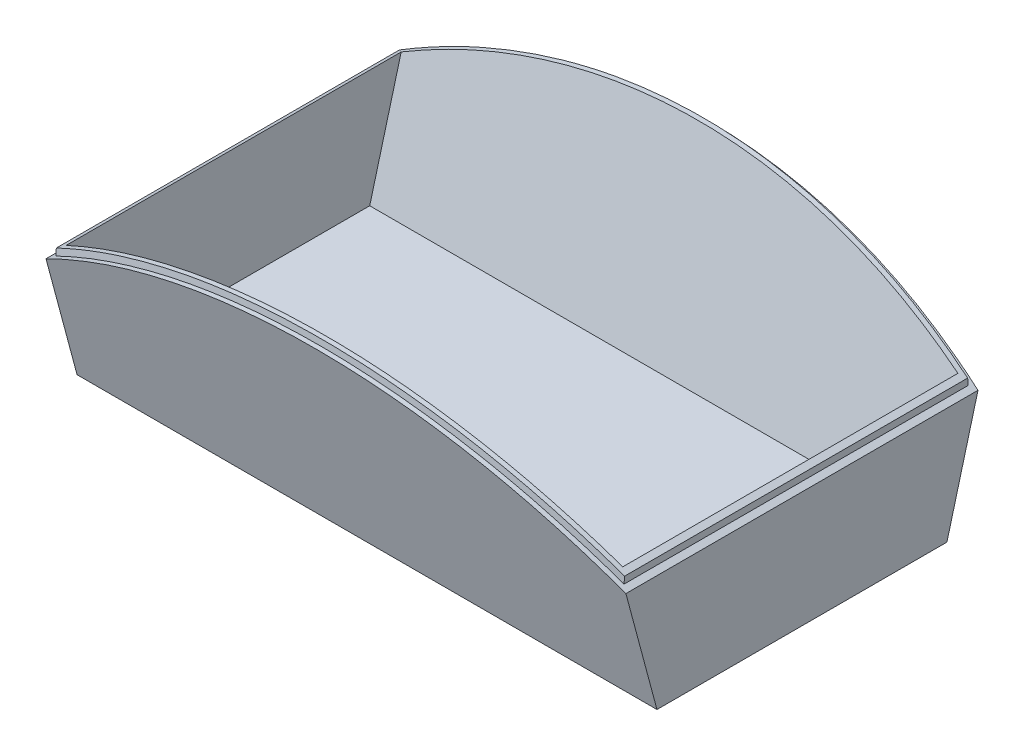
SolidWorks part; units mm, degrees
ref_plane "Płaszczyzna przednia" through (0, 0, 0) normal (0, 0, 1) x (1, 0, 0)
ref_plane "Płaszczyzna górna" through (0, 0, 0) normal (0, 1, 0) x (1, 0, 0)
ref_plane "Płaszczyzna prawa" through (0, 0, 0) normal (1, 0, 0) x (0, 0, -1)
body saved out of another part "Zapas-Przykład-1"
sketch3d "Szkic 3D4"
  spline S0 degree 3 poles (-174.8395, -1884.9923, -480.6472) (109.277, -830.1738, -198.7777) (249.2734, -57.4636, 8.3553) (36.4942, 27.5798, 31.1538) (35.4962, 27.9605, 31.2558) (33.4846, 28.6913, 31.4518) (32.4697, 29.0419, 31.5457) (29.4186, 30.0418, 31.8138) (27.3725, 30.6408, 31.9744) (21.1984, 32.2393, 32.4029) (17.035, 33.041, 32.6178) (8.6141, 34.1189, 32.9068) (4.3566, 34.3953, 32.9809) (-2.1034, 34.3985, 32.9818) (-4.2563, 34.3307, 32.9636) (-8.5528, 34.0577, 32.8904) (-10.6939, 33.8526, 32.8354) (-17.0672, 33.0371, 32.6168) (-21.2611, 32.2269, 32.3996) (-26.4352, 30.8824, 32.0392) (-27.4666, 30.5969, 31.9626) (-29.5225, 29.9923, 31.8005) (-30.5484, 29.6728, 31.7149) (-33.5991, 28.6691, 31.4458) (-35.5999, 27.9392, 31.2501) (-285.4338, -72.1741, 4.4117) (-26.6461, -1104.7346, -272.3761) (101.1367, -1896.3411, -483.1664) knots -6.558397 -6.558397 -6.558397 -6.558397 0.125 0.125 0.15625 0.15625 0.1875 0.1875 0.25 0.25 0.375 0.375 0.5 0.5 0.5625 0.5625 0.625 0.625 0.75 0.75 0.78125 0.78125 0.8125 0.8125 0.875 0.875 8.743806 8.743806 8.743806 8.743806 only from (49, 21.7151, 29.5816) to (-49, 21.7151, 29.5816)
  spline S1 degree 3 poles (49, 21.7151, 29.5816) (45.2837, 23.777, 30.1343) (41.4456, 25.6008, 30.6232) (36.4942, 27.5798, 31.1538) (35.4962, 27.9605, 31.2558) (33.4846, 28.6913, 31.4518) (32.4697, 29.0419, 31.5457) (29.4186, 30.0418, 31.8138) (27.3725, 30.6408, 31.9744) (21.1984, 32.2393, 32.4029) (17.035, 33.041, 32.6178) (8.6141, 34.1189, 32.9068) (4.3566, 34.3953, 32.9809) (-2.1034, 34.3985, 32.9818) (-4.2563, 34.3307, 32.9636) (-8.5528, 34.0577, 32.8904) (-10.6939, 33.8526, 32.8354) (-17.0672, 33.0371, 32.6168) (-21.2611, 32.2269, 32.3996) (-26.4352, 30.8824, 32.0392) (-27.4666, 30.5969, 31.9626) (-29.5225, 29.9923, 31.8005) (-30.5484, 29.6728, 31.7149) (-33.5991, 28.6691, 31.4458) (-35.5999, 27.9392, 31.2501) (-41.5061, 25.5725, 30.6157) (-45.3157, 23.7592, 30.1295) (-49, 21.7151, 29.5816) knots 0 0 0 0 0.125 0.125 0.15625 0.15625 0.1875 0.1875 0.25 0.25 0.375 0.375 0.5 0.5 0.5625 0.5625 0.625 0.625 0.75 0.75 0.78125 0.78125 0.8125 0.8125 0.875 0.875 1 1 1 1
  spline S2 degree 3 poles (1904.2226, -169.4819, -21.5433) (-190.0932, -440.6396, -93.8494) (-183.9652, -33.1605, 15.2882) (-35.5338, 26.8955, 31.3722) (-33.534, 27.6314, 31.5693) (-29.4818, 28.9766, 31.9296) (-27.4367, 29.5837, 32.0922) (-23.3083, 30.6666, 32.3822) (-21.2225, 31.1429, 32.5098) (-17.0253, 31.9607, 32.7288) (-14.9157, 32.3019, 32.8202) (-10.6745, 32.8491, 32.9667) (-8.5405, 33.0551, 33.0218) (-4.2704, 33.3291, 33.0953) (-2.1327, 33.3976, 33.1136) (2.1479, 33.3973, 33.1135) (4.2909, 33.3282, 33.095) (8.5596, 33.0534, 33.0214) (10.6882, 32.8477, 32.9663) (14.9336, 32.2993, 32.8194) (17.046, 31.9571, 32.7278) (21.2391, 31.1393, 32.5088) (23.3227, 30.6632, 32.3813) (27.4567, 29.578, 32.0907) (29.5015, 28.9705, 31.928) (33.547, 27.6266, 31.5681) (35.5506, 26.8891, 31.3705) (238.1801, -55.1402, 9.4017) (123.0971, -763.8034, -180.4049) (-198.4863, -1882.6255, -480.8549) knots -4.514782 -4.514782 -4.514782 -4.514782 0.125 0.125 0.1875 0.1875 0.25 0.25 0.3125 0.3125 0.375 0.375 0.4375 0.4375 0.5 0.5 0.5625 0.5625 0.625 0.625 0.6875 0.6875 0.75 0.75 0.8125 0.8125 0.875 0.875 7.229433 7.229433 7.229433 7.229433 only from (-49, 20.5697, 29.6781) to (49, 20.5697, 29.6781)
  spline S3 degree 3 poles (-49, 20.5697, 29.6781) (-45.2963, 22.6516, 30.2357) (-41.4524, 24.5008, 30.7309) (-35.5338, 26.8955, 31.3722) (-33.534, 27.6314, 31.5693) (-29.4818, 28.9766, 31.9296) (-27.4367, 29.5837, 32.0922) (-23.3083, 30.6666, 32.3822) (-21.2225, 31.1429, 32.5098) (-17.0253, 31.9607, 32.7288) (-14.9157, 32.3019, 32.8202) (-10.6745, 32.8491, 32.9667) (-8.5405, 33.0551, 33.0218) (-4.2704, 33.3291, 33.0953) (-2.1327, 33.3976, 33.1136) (2.1479, 33.3973, 33.1135) (4.2909, 33.3282, 33.095) (8.5596, 33.0534, 33.0214) (10.6882, 32.8477, 32.9663) (14.9336, 32.2993, 32.8194) (17.046, 31.9571, 32.7278) (21.2391, 31.1393, 32.5088) (23.3227, 30.6632, 32.3813) (27.4567, 29.578, 32.0907) (29.5015, 28.9705, 31.928) (33.547, 27.6266, 31.5681) (35.5506, 26.8891, 31.3705) (41.4714, 24.4922, 30.7286) (45.2964, 22.6515, 30.2356) (49, 20.5697, 29.6781) knots 0 0 0 0 0.125 0.125 0.1875 0.1875 0.25 0.25 0.3125 0.3125 0.375 0.375 0.4375 0.4375 0.5 0.5 0.5625 0.5625 0.625 0.625 0.6875 0.6875 0.75 0.75 0.8125 0.8125 0.875 0.875 1 1 1 1
  dimension "D1" = 0.2
  dimension "D2" = 0.2
sketch3d "Szkic 3D5"
  line L0 (-49, 21.7151, 29.5816) -> (-49, 20.5697, 29.6781)
  line L1 (49, 21.7151, 29.5816) -> (49, 20.5697, 29.6781)
surface "Powierzchnia-Wyciągnięcie po profilach2"
other "Zastąp ścianę2"
mirror "Lustro1" about plane through (0, 0, 0) normal (0, 0, 1)
other "Zastąp ścianę3"
